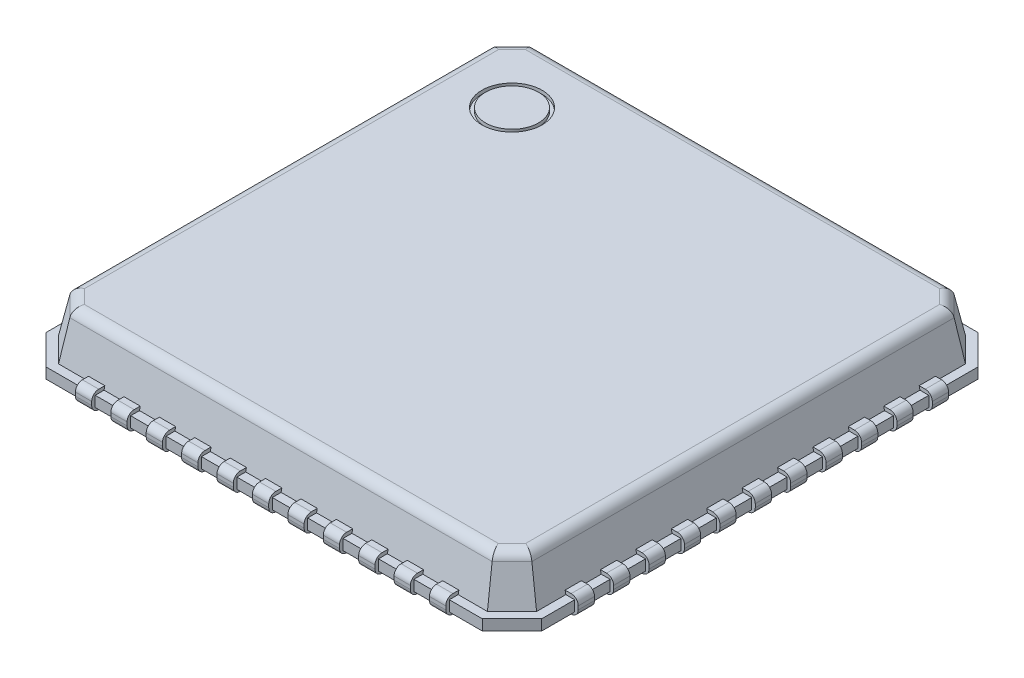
SolidWorks part; units mm, degrees
ref_plane "Front" through (0, 0, 0) normal (0, 0, 1) x (1, 0, 0)
ref_plane "Top" through (0, 0, 0) normal (0, 1, 0) x (1, 0, 0)
ref_plane "Right" through (0, 0, 0) normal (1, 0, 0) x (0, 0, -1)
sketch "Эскиз1" plane through (0, 0, 0) normal (0, 1, 0) x (1, 0, 0)
  line L0 (-3.5, 3.08) -> (-3.08, 3.5)
  line L1 (-3.08, -3.5) -> (3.08, -3.5)
  line L2 (-3.5, -3.08) -> (-3.5, 3.08)
  line L3 (-3.08, 3.5) -> (3.08, 3.5)
  line L4 (3.5, -3.08) -> (3.5, 3.08)
  line L5 (3.08, 3.5) -> (3.5, 3.08)
  line L6 (-3.5, -3.08) -> (-3.08, -3.5)
  line L7 (3.08, -3.5) -> (3.5, -3.08)
  line L8 (0, -3.5) -> (0, 3.5) construction
  dimension "D1" = 0.42
  dimension "D2" = 45
  dimension "A" = 7
  dimension "D4" = 7
extrude "Вытянуть1" add sketch "Эскиз1" along normal blind 0.15 from offset 0.05
sketch "Эскиз2" plane through (0, 0.2, 0) normal (0, 1, 0) x (-1, 0, 0)
  line L0 (3.0282, -3.375) -> (3.375, -3.0282)
  line L1 (3.375, -3.0282) -> (3.375, 3.0282)
  line L2 (3.375, 3.0282) -> (3.0282, 3.375)
  line L3 (3.0282, 3.375) -> (-3.0282, 3.375)
  line L4 (-3.0282, 3.375) -> (-3.375, 3.0282)
  line L5 (-3.375, 3.0282) -> (-3.375, -3.0282)
  line L6 (-3.375, -3.0282) -> (-3.0282, -3.375)
  line L7 (-3.0282, -3.375) -> (3.0282, -3.375)
  line L8 (3.08, -3.5) -> (3.5, -3.08)
  line L9 (-3.08, -3.5) -> (3.08, -3.5)
  line L10 (-3.5, -3.08) -> (-3.08, -3.5)
  line L11 (-3.5, 3.08) -> (-3.5, -3.08)
  line L12 (-3.08, 3.5) -> (-3.5, 3.08)
  line L13 (3.08, 3.5) -> (-3.08, 3.5)
  line L14 (3.5, 3.08) -> (3.08, 3.5)
  line L15 (3.5, -3.08) -> (3.5, 3.08)
  line L16 (3.08, -3.5) -> (3.5, -3.08) construction
  line L17 (-3.08, -3.5) -> (3.08, -3.5) construction
  line L18 (-3.5, -3.08) -> (-3.08, -3.5) construction
  line L19 (-3.5, 3.08) -> (-3.5, -3.08) construction
  line L20 (-3.08, 3.5) -> (-3.5, 3.08) construction
  line L21 (3.08, 3.5) -> (-3.08, 3.5) construction
  line L22 (3.5, 3.08) -> (3.08, 3.5) construction
  line L23 (3.5, -3.08) -> (3.5, 3.08) construction
  dimension "D3" = 0.25
  dimension "D1" = 0
  dimension "D2" = 0.125
extrude "Вытянуть2" add sketch "Эскиз2" along normal offset from surface 0.85 draft 12
ref_plane "Плоскость1" through (0, 0, -2.5) normal (0, 0, 1) x (1, 0, 0)
sketch "Эскиз3" plane through (0, 0, -2.5) normal (0, 0, 1) x (1, 0, 0)
  line L0 (-3.5, 0.05) -> (-3.08, 0.05) construction
  line L1 (-3.5, 0.2) -> (-3.5, 0.05) construction
  line L2 (-3.5, 0.2) -> (-3.08, 0.2) construction
  line L3 (-3.5, 0.05) -> (-3.08, 0.05) construction
  line L4 (-3.5, 0.2) -> (-3.5, 0.05) construction
  line L5 (-3.5, 0.2) -> (-3.08, 0.2) construction
  line L6 (3.5, 0.2) -> (3.5, 0.05) construction
  line L7 (3.08, 0.2) -> (3.5, 0.2) construction
  line L8 (3.08, 0.05) -> (3.5, 0.05) construction
  line L9 (3.5, 0.2) -> (3.5, 0.05) construction
  line L10 (3.08, 0.2) -> (3.5, 0.2) construction
  line L11 (3.08, 0.05) -> (3.5, 0.05) construction
  line L12 (-3.45, 0.25) -> (-3.08, 0.25)
  line L13 (-3.55, 0.15) -> (-3.55, 0.1)
  line L14 (-3.45, 0) -> (-3.08, 0)
  line L15 (3.08, 0.25) -> (3.45, 0.25)
  line L16 (3.55, 0.15) -> (3.55, 0.1)
  line L17 (3.08, 0) -> (3.45, 0)
  line L18 (-3.55, 0.25) -> (-3.08, 0.25) construction
  line L19 (-3.55, 0.25) -> (-3.55, 0) construction
  line L20 (-3.55, 0) -> (-3.08, 0) construction
  line L21 (3.08, 0.25) -> (3.55, 0.25) construction
  line L22 (3.55, 0.25) -> (3.55, 0) construction
  line L23 (3.08, 0) -> (3.55, 0) construction
  line L24 (3.08, 0.25) -> (3.08, 0)
  line L25 (-3.08, 0.25) -> (-3.08, 0)
  arc A0 (-3.45, 0.25) -> (-3.55, 0.15) centre (-3.45, 0.15) ccw
  arc A1 (-3.55, 0.1) -> (-3.45, 0) centre (-3.45, 0.1) ccw
  arc A2 (3.45, 0.25) -> (3.55, 0.15) centre (3.45, 0.15) cw
  arc A3 (3.55, 0.1) -> (3.45, 0) centre (3.45, 0.1) cw
  dimension "D2" = 0.1
  dimension "D4" = 0.1
  dimension "D1" = 0.05
  dimension "D3" = 0.05
extrude "Вытянуть3" add sketch "Эскиз3" along normal mid plane 0.23
fillet "Скругление2" radius 0.1 4 edges at (3.08, 0.025, -2.615) (3.08, 0.025, -2.385) (-3.08, 0.025, -2.385) (-3.08, 0.025, -2.615)
ref_plane "Плоскость2" through (-2.5, 0, 0) normal (1, 0, 0) x (0, 0, -1)
sketch "Эскиз4" plane through (-2.5, 0, 0) normal (1, 0, 0) x (0, 0, -1)
  line L0 (3.5, 0.2) -> (3.5, 0.05) construction
  line L1 (3.08, 0.2) -> (3.5, 0.2) construction
  line L2 (3.08, 0.05) -> (3.5, 0.05) construction
  line L3 (-3.5, 0.05) -> (-3.08, 0.05) construction
  line L4 (-3.5, 0.2) -> (-3.5, 0.05) construction
  line L5 (-3.5, 0.2) -> (-3.08, 0.2) construction
  line L6 (3.5, 0.2) -> (3.5, 0.05) construction
  line L7 (3.08, 0.2) -> (3.5, 0.2) construction
  line L8 (3.08, 0.05) -> (3.5, 0.05) construction
  line L9 (-3.5, 0.05) -> (-3.08, 0.05) construction
  line L10 (-3.5, 0.2) -> (-3.5, 0.05) construction
  line L11 (-3.5, 0.2) -> (-3.08, 0.2) construction
  line L12 (3.08, 0.25) -> (3.45, 0.25)
  line L13 (3.55, 0.15) -> (3.55, 0.1)
  line L14 (3.08, 0) -> (3.45, 0)
  line L15 (-3.45, 0.25) -> (-3.08, 0.25)
  line L16 (-3.55, 0.15) -> (-3.55, 0.1)
  line L17 (-3.45, 0) -> (-3.08, 0)
  line L18 (-3.55, 0.25) -> (-3.08, 0.25) construction
  line L19 (-3.55, 0.25) -> (-3.55, 0) construction
  line L20 (-3.55, 0) -> (-3.08, 0) construction
  line L21 (3.55, 0.25) -> (3.55, 0) construction
  line L22 (3.08, 0) -> (3.55, 0) construction
  line L23 (3.08, 0.25) -> (3.55, 0.25) construction
  line L24 (-3.08, 0) -> (-3.08, 0.25)
  line L25 (3.08, 0.25) -> (3.08, 0)
  arc A0 (-3.45, 0.25) -> (-3.55, 0.15) centre (-3.45, 0.15) ccw
  arc A1 (-3.55, 0.1) -> (-3.45, 0) centre (-3.45, 0.1) ccw
  arc A2 (3.55, 0.1) -> (3.45, 0) centre (3.45, 0.1) cw
  arc A3 (3.45, 0.25) -> (3.55, 0.15) centre (3.45, 0.15) cw
  dimension "D3" = 0.1
  dimension "D1" = 0.05
  dimension "D2" = 0.05
extrude "Вытянуть4" add sketch "Эскиз4" along normal mid plane 0.23
fillet "Скругление1" radius 0.1 4 edges at (-2.385, 0.025, -3.08) (-2.615, 0.025, -3.08) (-2.615, 0.025, 3.08) (-2.385, 0.025, 3.08)
fillet "Скругление3" radius 0.15 8 edges at (3.2368, 0.85, 0) (3.1039, 0.85, 3.1039) (0, 0.85, 3.2368) (-3.1039, 0.85, 3.1039) (-3.2368, 0.85, 0) (-3.1039, 0.85, -3.1039) (0, 0.85, -3.2368) (3.1039, 0.85, -3.1039)
sketch "Эскиз5" plane through (0, 0.85, 0) normal (0, 1, 0) x (-1, 0, 0)
  line L0 (2.3109, -2.3109) -> (3.018, -3.018) construction
  line L1 (2.9207, -3.1154) -> (3.1154, -2.9207) construction
  line L2 (3.08, -3.5) -> (3.5, -3.08) construction
  circle A0 centre (2.3109, -2.3109) radius 0.4
  dimension "D1" = 0.8
  dimension "D2" = 1
extrude "Вырез-Вытянуть-Тонкостенный1" cut sketch "Эскиз5" against normal blind 0.05 thin
pattern_linear "Линейный массив1" count 11 spacing 0.5 along (0, 0, 1) of "Вытянуть3", "Скругление2"
pattern_linear "Линейный массив2" count 11 spacing 0.5 along (1, 0, 0) of "Вытянуть4", "Скругление1"
sketch "Эскиз6" plane through (0, 0.05, 0) normal (0, -1, 0) x (1, 0, 0)
  line L0 (-2.55, -2.3) -> (-2.55, -2.4)
  line L1 (2.4, 2.55) -> (-2.4, 2.55)
  line L2 (2.55, 2.4) -> (2.55, -2.4)
  line L3 (2.4, -2.55) -> (-2.4, -2.55)
  line L4 (-2.55, 2.4) -> (-2.55, -1.9)
  line L5 (0, 2.55) -> (0, 0) construction
  line L6 (0, 0) -> (2.55, 0) construction
  arc A0 (-2.55, -2.3) -> (-2.55, -1.9) centre (-2.55, -2.1) ccw
  arc A1 (2.55, -2.4) -> (2.4, -2.55) centre (2.4, -2.4) cw
  arc A2 (-2.4, -2.55) -> (-2.55, -2.4) centre (-2.4, -2.4) cw
  arc A3 (-2.4, 2.55) -> (-2.55, 2.4) centre (-2.4, 2.4) ccw
  arc A4 (2.4, 2.55) -> (2.55, 2.4) centre (2.4, 2.4) cw
  dimension "D1" = 0.15
  dimension "D4" = 0.45
  dimension "D5" = 0.2
  dimension "D2" = 5.1
  dimension "D" = 5.1
extrude "Вытянуть5" add sketch "Эскиз6" along normal blind 0.05
equation "\"D4@Эскиз1\" = \"A@Эскиз1\""
equation "\"D1@Плоскость2\" = \"Pin1@Плоскость1\""
equation "\"D1@Вытянуть4\" = \"b@Вытянуть3\""
equation "\"D1@Линейный массив2\" = \"N@Линейный массив1\""
equation "\"D2@Эскиз6\" = \"D@Эскиз6\""
equation "\"D3@Линейный массив2\" = \"e@Линейный массив1\""
